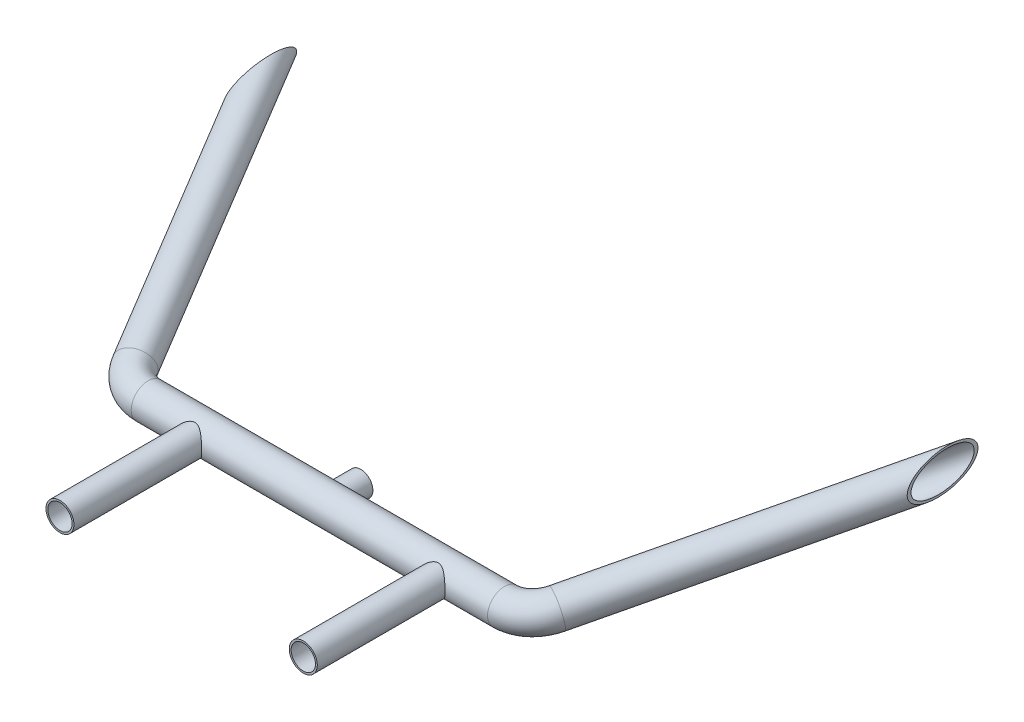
SolidWorks part; units mm, degrees
ref_plane "Plan1" through (0, 0, 0) normal (0, 0, 1) x (1, 0, 0)
ref_plane "Plan2" through (0, 0, 0) normal (0, 1, 0) x (1, 0, 0)
ref_plane "Plan3" through (0, 0, 0) normal (1, 0, 0) x (0, 0, -1)
sketch "Esquisse2" plane through (0, 0, 0) normal (0, 1, 0) x (1, 0, 0)
  line L0 (-300, -226) -> (299, -226) construction
  dimension "D1" = 226
ref_plane "Plan4" through (0, 47.4442, 10.4425) normal (0, 0.9766, 0.215) x (-1, 0, 0)
sketch "Esquisse3" plane through (0, 47.4442, 10.4425) normal (0, 0.9766, 0.215) x (-1, 0, 0)
  line L0 (-146.4438, 220.717) -> (146.4438, 220.717)
  line L1 (300, 220.717) -> (-299, 220.717) construction
  line L2 (-173.2864, 204.1137) -> (-235.8368, 78.7831)
  line L3 (173.2864, 204.1137) -> (235.8368, 78.7831)
  line L4 (165, 220.717) -> (280.4925, -10.6924) construction
  line L5 (-165, 220.717) -> (-280.4925, -10.6924) construction
  arc A0 (173.2864, 204.1137) -> (146.4438, 220.717) centre (146.4438, 190.717) ccw
  arc A1 (-146.4438, 220.717) -> (-173.2864, 204.1137) centre (-146.4438, 190.717) ccw
  dimension "D3" = 30
  dimension "D1" = 330
  dimension "D2" = 100
sketch "Esquisse6" plane through (0, 47.4442, 10.4425) normal (0, 0.9766, 0.215) x (-1, 0, 0)
  line L0 (173.2864, 204.1137) -> (235.8368, 78.7831) construction
  line L1 (-146.4438, 220.717) -> (146.4438, 220.717) construction
  line L3 (173.2864, 204.1137) -> (235.8368, 78.7831)
  line L4 (0, 220.717) -> (146.4438, 220.717)
  line L5 (300, 220.717) -> (-299, 220.717) construction
  line L6 (0, 50) -> (0, -50) construction
  arc A0 (173.2864, 204.1137) -> (146.4438, 220.717) centre (146.4438, 190.717) ccw construction
  arc A2 (173.2864, 204.1137) -> (146.4438, 220.717) centre (146.4438, 190.717) ccw
  dimension "D1" = 100
sketch "Esquisse7" plane through (0, 47.4442, 10.4425) normal (0, 0.9766, 0.215) x (-1, 0, 0)
  line L0 (-173.2864, 204.1137) -> (-235.8368, 78.7831) construction
  line L1 (-173.2864, 204.1137) -> (-235.8368, 78.7831)
  line L2 (-146.4438, 220.717) -> (0, 220.717)
  line L3 (300, 220.717) -> (-299, 220.717) construction
  line L4 (0, 50) -> (0, -50) construction
  arc A0 (-146.4438, 220.717) -> (-173.2864, 204.1137) centre (-146.4438, 190.717) ccw construction
  arc A1 (-146.4438, 220.717) -> (-173.2864, 204.1137) centre (-146.4438, 190.717) ccw
  dimension "D1" = 100
sketch "Esquisse8" plane through (0, 0, 0) normal (1, 0, 0) x (0, 0, -1)
  line L0 (105.4125, 72.9439) -> (-126.2974, 21.9445) construction
  circle A0 centre (-226, 0) radius 14
  dimension "D1" = 28
sweep "Base-Balayage" add profiles "Esquisse8" path "Esquisse7"
sketch "Esquisse9" plane through (0, 0, 0) normal (-1, 0, 0) x (0, 0, 1)
  circle A1 centre (226, 0) radius 14
  circle A2 centre (226, 0) radius 14
  dimension "D1" = 0
sweep "Boss.-Balayage1" add profiles "Esquisse9" path "Esquisse6"
sketch "Esquisse10" plane through (15.5504, 6.6976, -30.4297) normal (0.4466, 0.1923, -0.8738) x (-0.8948, 0.096, -0.4361)
  circle A2 centre (-246.1973, 48.5798) radius 12.5
  circle A3 centre (-246.1973, 48.5798) radius 12.5
  dimension "D1" = 1.5
sweep "Enlèvement de matière-Balayage2" cut profiles "Esquisse10" path "Esquisse3"
sketch "Esquisse11" plane through (15.5504, 6.6976, -30.4297) normal (0.4466, 0.1923, -0.8738) x (-0.8948, 0.096, -0.4361)
  circle A0 centre (-246.1973, 48.5798) radius 12.5 construction
  circle A1 centre (-246.1973, 48.5798) radius 14
  circle A2 centre (-246.1973, 48.5798) radius 14
  circle A3 centre (-246.1973, 48.5798) radius 12.5
  dimension "D1" = 0
extrude "Boss.-Extru.1" add sketch "Esquisse11" along normal up to surface (123.3341 mm away)
sketch "Esquisse12" plane through (-15.5504, 6.6976, -30.4297) normal (-0.4466, 0.1923, -0.8738) x (-0.8948, -0.096, 0.4361)
  circle A0 centre (246.1973, 48.5798) radius 12.5 construction
  circle A1 centre (246.1973, 48.5798) radius 14
  circle A2 centre (246.1973, 48.5798) radius 14
  circle A3 centre (246.1973, 48.5798) radius 12.5
  dimension "D1" = 0
extrude "Boss.-Extru.2" add sketch "Esquisse12" along normal up to surface (76.6659 mm away)
ref_plane "Plan5" through (0, 0, 225) normal (0, 0, 1) x (1, 0, 0)
sketch "Esquisse13" plane through (0, 0, 225) normal (0, 0, 1) x (1, 0, 0)
  line L1 (0, 100) -> (0, -80) construction
  line L2 (146.4438, 0) -> (-146.4438, 0) construction
  circle A0 centre (-100, 0) radius 11.5
  circle A1 centre (100, 0) radius 11.5
  circle A2 centre (-100, 0) radius 10
  circle A3 centre (100, 0) radius 10
  dimension "D1" = 23
  dimension "D2" = 20
  dimension "D3" = 100
extrude "Boss.-Extru.3" add sketch "Esquisse13" along normal blind 120
sketch "Esquisse14" plane through (0, 0, 225) normal (0, 0, 1) x (1, 0, 0)
  circle A0 centre (0, 0) radius 6
  circle A1 centre (0, 0) radius 10
  dimension "D1" = 20
  dimension "D2" = 12
extrude "Boss.-Extru.4" add sketch "Esquisse14" against normal blind 27.2114
